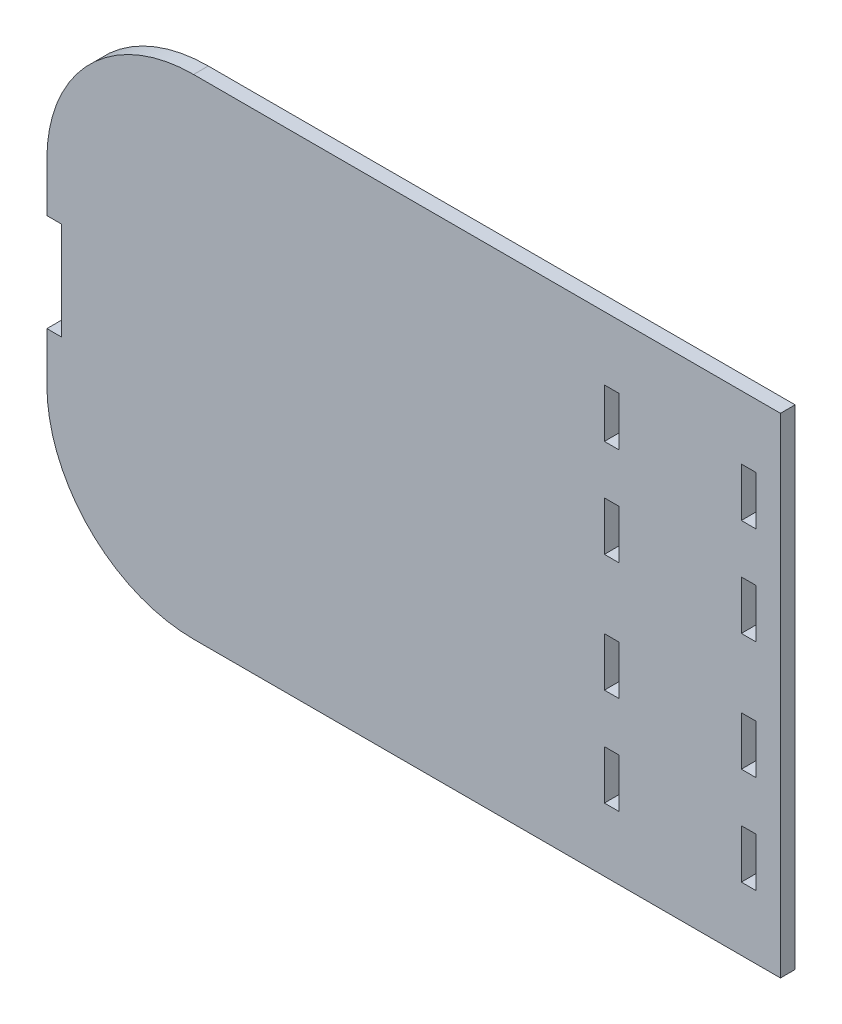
SolidWorks part; units mm, degrees
ref_plane "Alzado" through (0, 0, 0) normal (0, 0, 1) x (1, 0, 0)
ref_plane "Planta" through (0, 0, 0) normal (0, 1, 0) x (1, 0, 0)
ref_plane "Vista lateral" through (0, 0, 0) normal (1, 0, 0) x (0, 0, -1)
sketch "Sketch1" plane through (0, 0, 0) normal (0, 0, 1) x (1, 0, 0)
  line L0 (-75, 0) -> (-73.65, 0) construction
  line L1 (75, -50) -> (-45, -50)
  line L2 (75, -50) -> (75, 50)
  line L3 (75, 50) -> (-45, 50)
  line L4 (-75, -20) -> (-75, -10)
  line L5 (75, -50) -> (-75, 50) construction
  line L6 (75, 50) -> (-75, -50) construction
  line L7 (70, 27.02) -> (67, 27.02)
  line L8 (70, 27.02) -> (70, 37.02)
  line L9 (70, 37.02) -> (67, 37.02)
  line L10 (67, 27.02) -> (67, 37.02)
  line L11 (70, 27.02) -> (67, 37.02) construction
  line L12 (70, 37.02) -> (67, 27.02) construction
  line L13 (70, -37.02) -> (67, -37.02)
  line L14 (70, -27.02) -> (70, -37.02)
  line L15 (70, -27.02) -> (67, -27.02)
  line L16 (67, -27.02) -> (67, -37.02)
  line L17 (67, 7.02) -> (67, 17.02)
  line L18 (70, 7.02) -> (67, 7.02)
  line L19 (70, 17.02) -> (67, 17.02)
  line L20 (70, 7.02) -> (70, 17.02)
  line L21 (67, -7.02) -> (67, -17.02)
  line L22 (70, -7.02) -> (67, -7.02)
  line L23 (70, -7.02) -> (70, -17.02)
  line L24 (70, -17.02) -> (67, -17.02)
  line L25 (0, 50) -> (0, -50) construction
  line L26 (39, 27.02) -> (39, 37.02)
  line L27 (42, 27.02) -> (39, 27.02)
  line L28 (42, 27.02) -> (42, 37.02)
  line L29 (42, 37.02) -> (39, 37.02)
  line L30 (39, 7.02) -> (39, 17.02)
  line L31 (42, 17.02) -> (39, 17.02)
  line L32 (42, 7.02) -> (42, 17.02)
  line L33 (42, 7.02) -> (39, 7.02)
  line L34 (42, -7.02) -> (39, -7.02)
  line L35 (39, -7.02) -> (39, -17.02)
  line L36 (42, -7.02) -> (42, -17.02)
  line L37 (42, -17.02) -> (39, -17.02)
  line L38 (42, -27.02) -> (39, -27.02)
  line L39 (39, -27.02) -> (39, -37.02)
  line L40 (42, -27.02) -> (42, -37.02)
  line L41 (42, -37.02) -> (39, -37.02)
  line L42 (-75, 10) -> (-75, 20)
  line L43 (-72, -10) -> (-75, -10)
  line L44 (-72, -10) -> (-72, 10)
  line L45 (-72, 10) -> (-75, 10)
  line L49 (-72, 0) -> (75, 0) construction
  arc A0 (-45, -50) -> (-75, -20) centre (-45, -20) cw
  arc A1 (-45, 50) -> (-75, 20) centre (-45, 20) ccw
  point P0 (0, 0)
  point P12 (68.5, 32.02)
  point P54 (-72, 0)
  point P55 (-73.5, 10)
extrude "Boss-Extrude1" add sketch "Sketch1" along normal blind 3
equation "\"kerf\" = 0.24'Laser part that the material eliminates"
equation "\"mwk\"= \"mw\" + \"kerf\""
equation "\"D5@Sketch1\"=\"mw\""
equation "\"D7@Sketch1\"=5"
equation "\"mw\" = 3"
equation "\"D14@Sketch1\"=\"mw\""
equation "\"D1@Boss-Extrude1\"=\"mw\""
